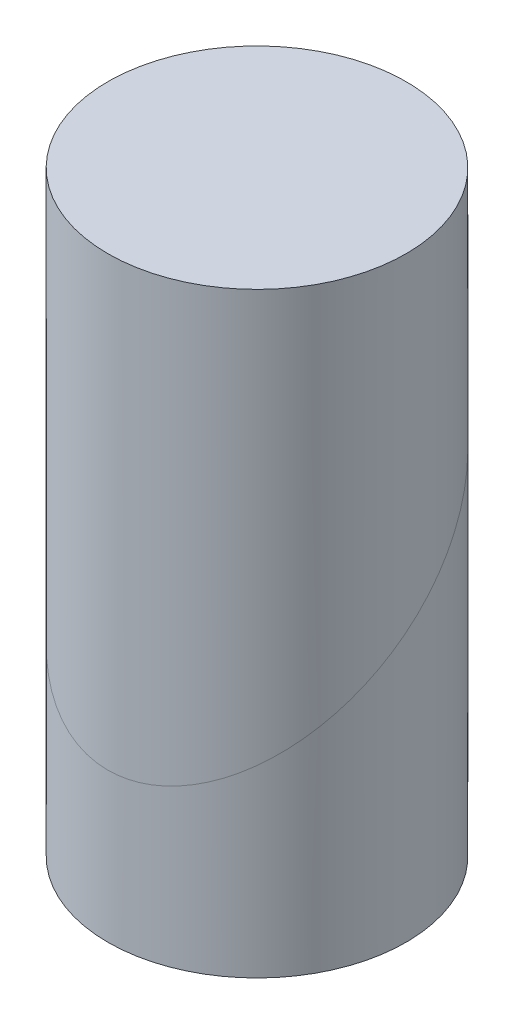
SolidWorks part; units mm, degrees
ref_plane "Front Plane" through (0, 0, 0) normal (0, 0, 1) x (1, 0, 0)
ref_plane "Top Plane" through (0, 0, 0) normal (0, 1, 0) x (1, 0, 0)
ref_plane "Right Plane" through (0, 0, 0) normal (1, 0, 0) x (0, 0, -1)
sketch "Skizze1" plane through (0, 0, 0) normal (0, 1, 0) x (1, 0, 0)
  circle A0 centre (0, 0) radius 25
  dimension "D1" = 50
extrude "Linear austragen1" add sketch "Skizze1" along normal blind 100
ref_plane "Ebene1" through (-25, 50, 0) normal (-1, 0, 0) x (0, 0, -1)
sketch "Skizze3" plane through (-25, 50, 0) normal (-1, 0, 0) x (0, 0, -1)
  line L0 (-25, 25) -> (25, -15)
  line L1 (-25, 50) -> (-25, -50) construction
  line L2 (25, -50) -> (25, 50) construction
  line L7 (0, -50) -> (0, 50) construction
  line L8 (-25, -50) -> (25, -50) construction
  dimension "D1" = 35
  dimension "D2" = 40
